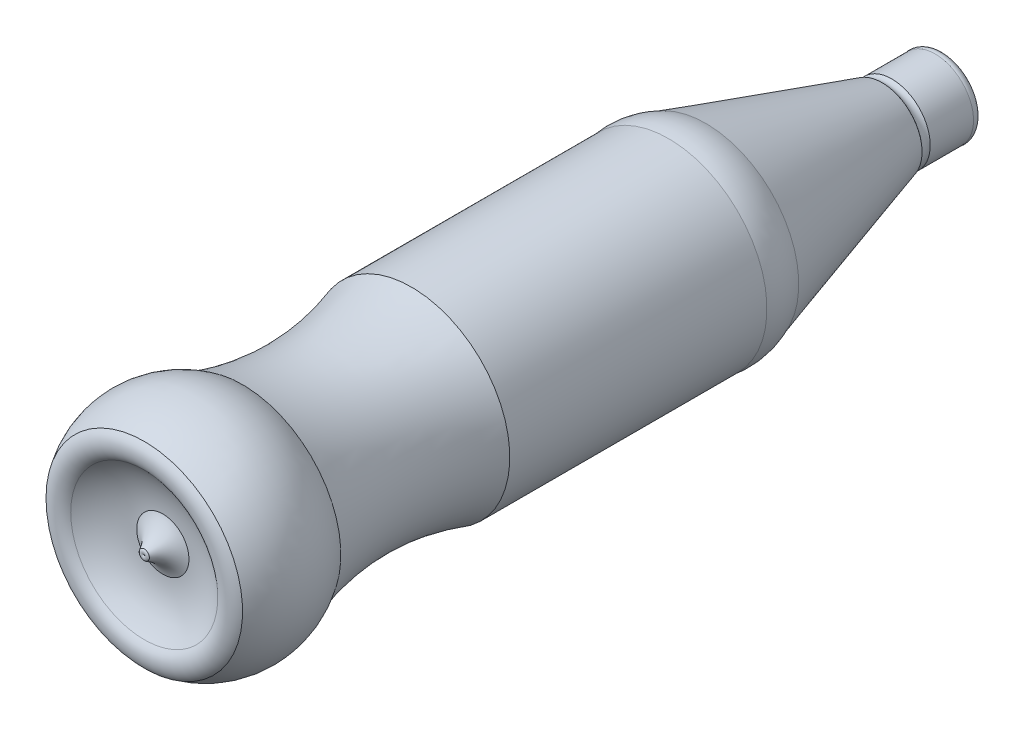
SolidWorks part; units mm, degrees
ref_plane "前视基准面" through (0, 0, 0) normal (0, 0, 1) x (1, 0, 0)
ref_plane "上视基准面" through (0, 0, 0) normal (0, 1, 0) x (1, 0, 0)
ref_plane "右视基准面" through (0, 0, 0) normal (1, 0, 0) x (0, 0, -1)
sketch "草图1" plane through (0, 0, 0) normal (0, 1, 0) x (1, 0, 0)
  line L0 (0, 113.622) -> (0, -146.378)
  line L1 (0, 113.622) -> (11.1011, 113.622)
  line L2 (12.5, 111.1099) -> (12.5, 97.0045)
  line L3 (13.0442, 93.8079) -> (30.2508, 36.4527)
  line L4 (32, 24.3398) -> (32, -59.378)
  arc A1 (32, -114.378) -> (32, -146.378) centre (8.4971, -130.378) cw
  arc A2 (32, -146.378) -> (23.9443, -146.378) centre (27.9721, -142.3501) cw
  arc A3 (23.9443, -146.378) -> (8.4971, -140.3361) centre (8.1136, -164.0844) ccw
  arc A5 (32, -59.378) -> (32, -114.378) centre (118.3373, -86.878) ccw
  arc A6 (30.2508, 36.4527) -> (32, 24.3398) centre (11.1011, 27.5046) cw
  arc A7 (11.1011, 113.622) -> (12.5, 111.1099) centre (10.5445, 111.6665) cw
  arc A8 (12.5, 97.0045) -> (13.0442, 93.8079) centre (14.3704, 95.6783) ccw
  arc A9 (0, -146.378) -> (1.6607, -146.378) centre (0.8304, -145.5476) ccw
  arc A10 (8.4971, -140.3361) -> (1.6607, -146.378) centre (12.6452, -151.9182) ccw
  point P3 (12.5, 97.0045)
  point P5 (30.2508, 36.4527)
  point P6 (11.1011, 113.622)
  point P7 (32, 24.3398)
  point P20 (12.5, 111.1099)
  point P24 (13.0442, 93.8079)
  dimension "D1" = 260
  dimension "D7" = 55
revolve "旋转1" add sketch "草图1" angle 360 about L0
